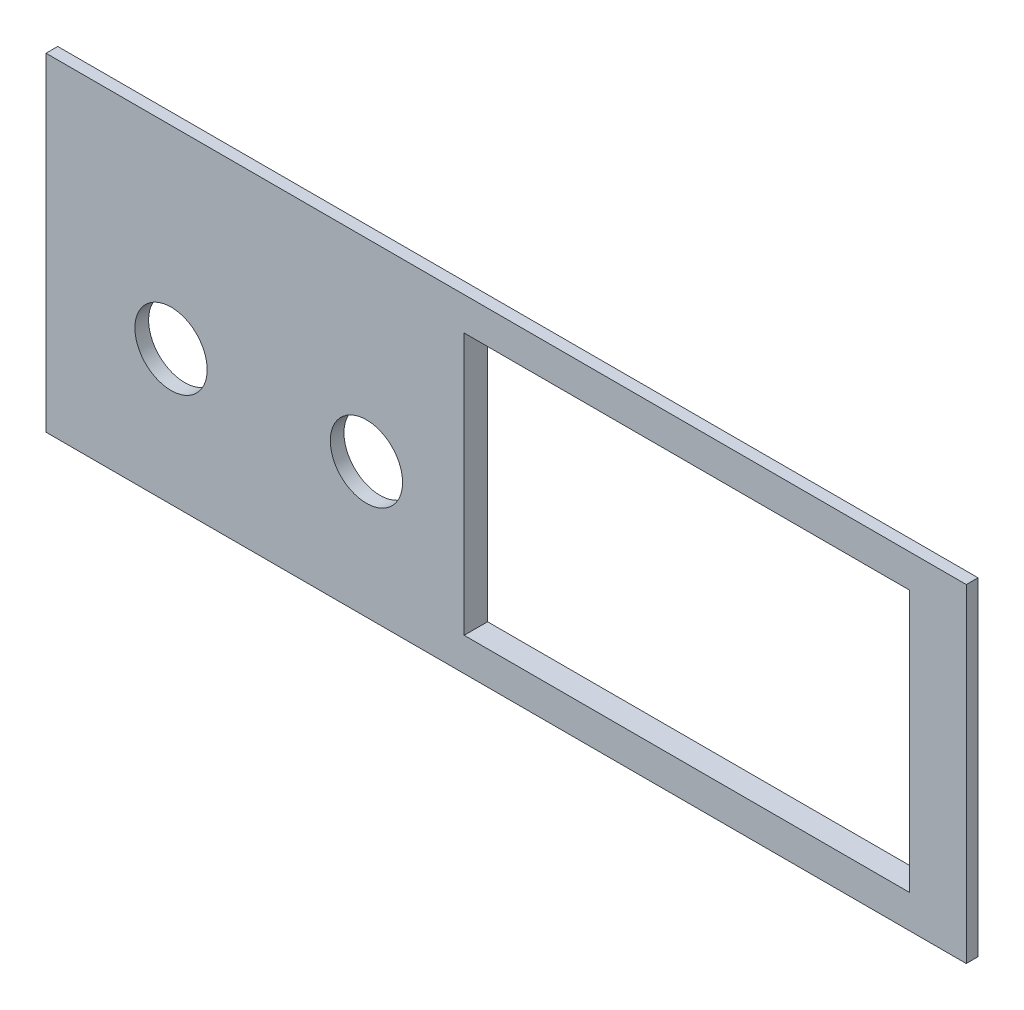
SolidWorks part; units mm, degrees
ref_plane "Спереди" through (0, 0, 0) normal (0, 0, 1) x (1, 0, 0)
ref_plane "Сверху" through (0, 0, 0) normal (0, 1, 0) x (1, 0, 0)
ref_plane "Справа" through (0, 0, 0) normal (1, 0, 0) x (0, 0, -1)
sketch "Эскиз1" plane through (0, 0, 0) normal (0, 0, 1) x (1, 0, 0)
  line L1 (-44.3, 15) -> (44.3, 15)
  line L2 (-44.3, 15) -> (-44.3, -15)
  line L3 (-44.3, -15) -> (44.3, -15)
  line L4 (44.3, 15) -> (44.3, -15)
  line L5 (-44.3, 15) -> (44.3, -15) construction
  line L6 (-44.3, -15) -> (44.3, 15) construction
  point P0 (0, 0)
  dimension "D1" = 88.6
  dimension "D2" = 30
extrude "Бобышка-Вытянуть1" add sketch "Эскиз1" along normal blind 1.2
sketch "Эскиз2" plane through (0, 0, 1.2) normal (0, 0, 1) x (1, 0, 0)
  line L0 (44.3, 15) -> (-44.3, 15) construction
  line L1 (-47.1, 16.8) -> (47.1, 16.8)
  line L2 (-47.1, 16.8) -> (-47.1, -16.8)
  line L3 (-47.1, -16.8) -> (47.1, -16.8)
  line L4 (47.1, 16.8) -> (47.1, -16.8)
  line L5 (-47.1, 16.8) -> (47.1, -16.8) construction
  line L6 (-47.1, -16.8) -> (47.1, 16.8) construction
  line L7 (44.3, -15) -> (44.3, 15) construction
  point P0 (0, 0)
  dimension "D1" = 1.8
  dimension "D2" = 2.8
  dimension "D3" = 94.2
extrude "Бобышка-Вытянуть2" add sketch "Эскиз2" along normal blind 1.2
sketch "Эскиз3" plane through (0, 0, 0) normal (0, 0, -1) x (-1, 0, 0)
  line L0 (-44.3, 0) -> (44.3, 0) construction
  line L1 (-44.3, -15) -> (-44.3, 15) construction
  line L2 (44.3, 15) -> (44.3, -15) construction
  line L4 (-41.3, 13.4) -> (4.3, 13.4)
  line L5 (-41.3, 13.4) -> (-41.3, -13.4)
  line L6 (-41.3, -13.4) -> (4.3, -13.4)
  line L7 (4.3, 13.4) -> (4.3, -13.4)
  line L8 (-41.3, 13.4) -> (4.3, -13.4) construction
  line L9 (-41.3, -13.4) -> (4.3, 13.4) construction
  circle A0 centre (14.3, -3) radius 3.7
  circle A1 centre (34.3, -3) radius 3.7
  circle A2 centre (14.3, -3) radius 8.5 construction
  circle A3 centre (34.3, -3) radius 8.5 construction
  point P13 (-18.5, 0)
  dimension "D1" = 7.4
  dimension "D7" = 17
  dimension "D8" = 3
  dimension "D2" = 20
  dimension "D3" = 10
  dimension "D4" = 45.6
  dimension "D5" = 26.8
  dimension "D6" = 10
extrude "Вырез-Вытянуть2" cut sketch "Эскиз3" against normal through all
sketch "Эскиз4" plane through (0, 0, 0) normal (0, 0, -1) x (-1, 0, 0)
  circle A0 centre (14.3, -3) radius 8
  circle A1 centre (34.3, -3) radius 8
  dimension "D1" = 16
extrude "Вырез-Вытянуть3" cut sketch "Эскиз4" against normal blind 1
sketch "Эскиз5" plane through (0, 0, 0) normal (0, 0, -1) x (-1, 0, 0)
  line L0 (14.3, -3) -> (14.3, 14.6437) construction
  line L3 (4.8187, 7) -> (23.7813, 7) construction
  line L4 (34.3, -3) -> (34.3, 14.6437) construction
  line L5 (45.6184, 7) -> (22.9816, 7) construction
  text T0 "<b>ТОК</b>"
  text T1 "<b>НАПР</b>"
  point P8 (14.3, 7)
  point P10 (34.3, 7)
  dimension "D1" = 10
extrude "Вырез-Вытянуть4" cut sketch "Эскиз5" against normal blind 1
